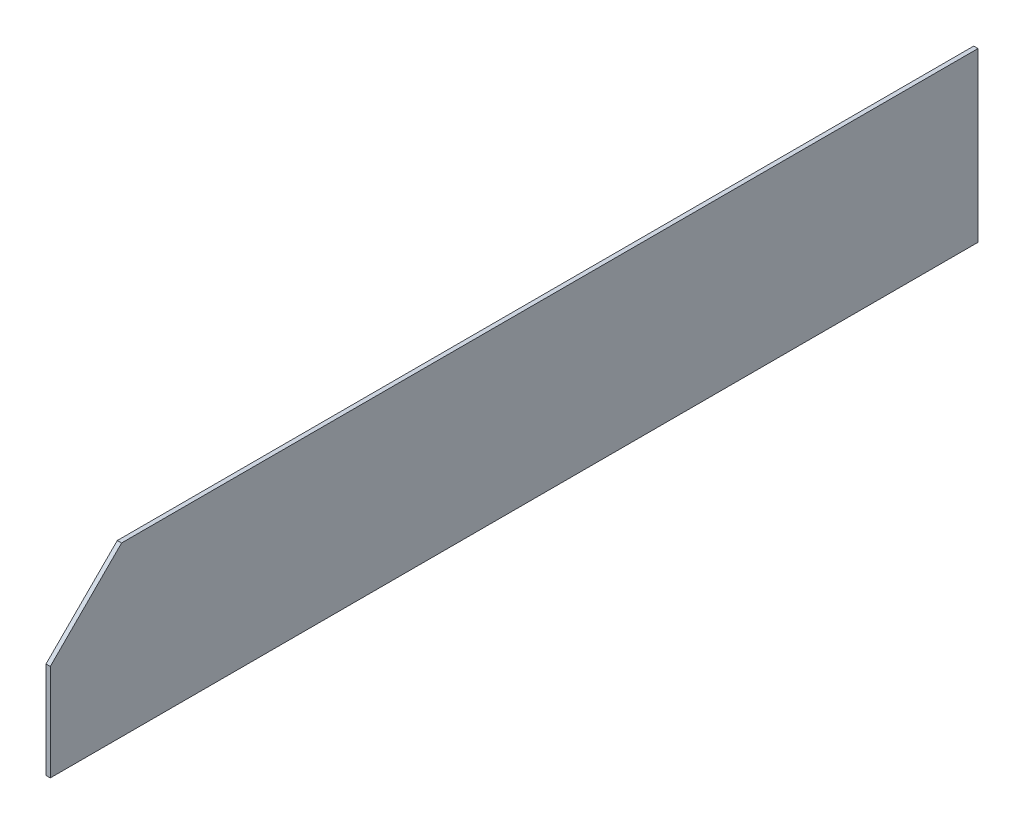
SolidWorks part; units mm, degrees
ref_plane "Front Plane" through (0, 0, 0) normal (0, 0, 1) x (1, 0, 0)
ref_plane "Top Plane" through (0, 0, 0) normal (0, 1, 0) x (1, 0, 0)
ref_plane "Right Plane" through (0, 0, 0) normal (1, 0, 0) x (0, 0, -1)
sketch "Sketch1" plane through (-607.5404, 0, 0) normal (1, 0, 0) x (0, 0, -1)
  line L0 (-1391.5908, 277.5506) -> (-1391.5908, 349.2605)
  line L1 (-1391.5908, 349.2605) -> (-1338.6392, 402.2121)
  line L2 (-1338.6392, 402.2121) -> (-702.6158, 402.2121)
  line L3 (-702.6158, 402.2121) -> (-702.6158, 277.5506)
  line L4 (-702.6158, 277.5506) -> (-1391.5908, 277.5506)
extrude "Boss-Extrude1" add sketch "Sketch1" against normal blind 3.175
